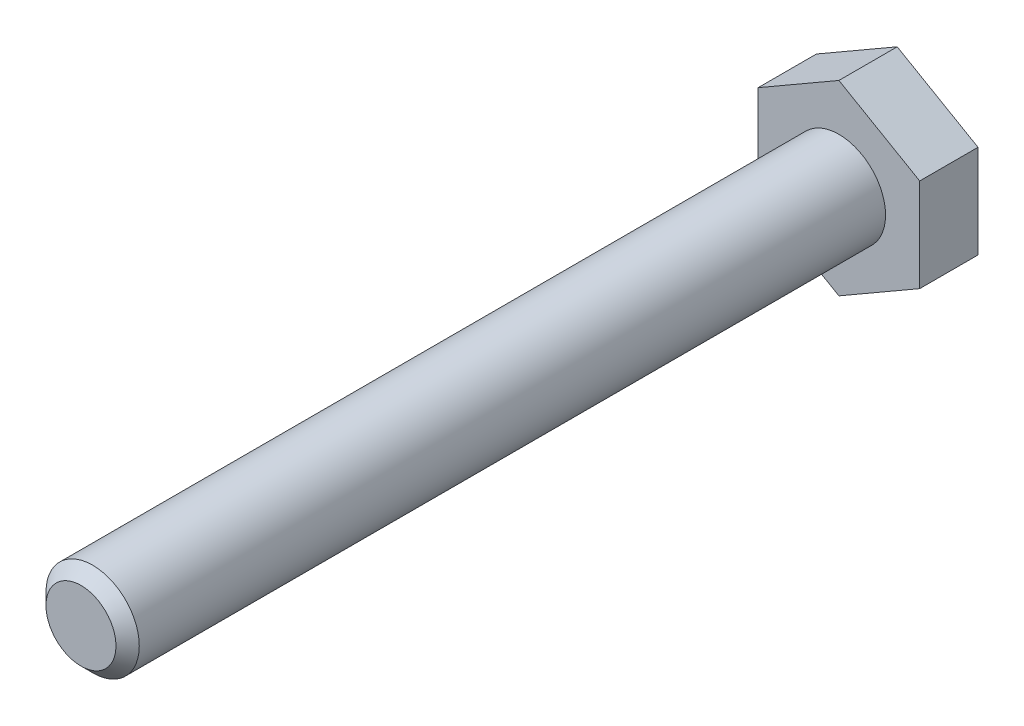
SolidWorks part; units mm, degrees
ref_plane "Face" through (0, 0, 0) normal (0, 0, 1) x (1, 0, 0)
ref_plane "Dessus" through (0, 0, 0) normal (0, 1, 0) x (1, 0, 0)
ref_plane "Droite" through (0, 0, 0) normal (1, 0, 0) x (0, 0, -1)
sketch "Esquisse1" plane through (0, 0, 0) normal (0, 0, 1) x (1, 0, 0)
  line L1 (0, 8) -> (-6.9282, 4)
  line L2 (-6.9282, 4) -> (-6.9282, -4)
  line L3 (-6.9282, -4) -> (0, -8)
  line L4 (0, -8) -> (6.9282, -4)
  line L5 (6.9282, -4) -> (6.9282, 4)
  line L6 (6.9282, 4) -> (0, 8)
  circle A0 centre (0, 0) radius 6.9282 construction
  dimension "D1" = 8
extrude "Base-Extrusion" add sketch "Esquisse1" along normal blind 70
sketch "Esquisse2" plane through (0, 0, 70) normal (0, 0, 1) x (1, 0, 0)
  circle A0 centre (0, 0) radius 4
  dimension "D1" = 8
extrude "Enlèv. mat.-Extru.1" cut sketch "Esquisse2" against normal blind 65 flip side to cut
ref_plane "Plan1" through (0, 0, 0) normal (-0.5, 0.866, 0) x (-0.866, -0.5, 0)
chamfer "Chanfrein1" distance 1 angle 45
